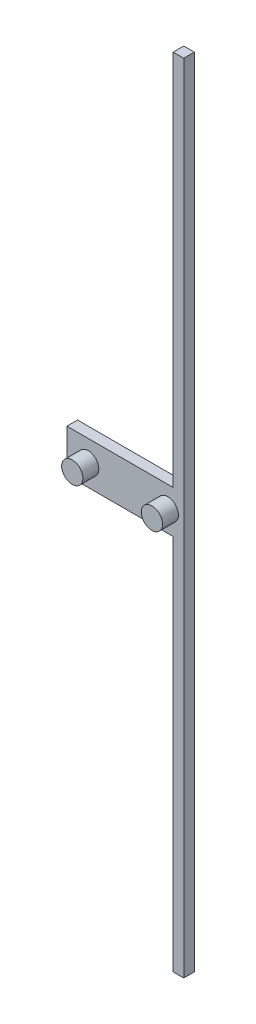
SolidWorks part; units mm, degrees
ref_plane "Face" through (0, 0, 0) normal (0, 0, 1) x (1, 0, 0)
ref_plane "Dessus" through (0, 0, 0) normal (0, 1, 0) x (1, 0, 0)
ref_plane "Droite" through (0, 0, 0) normal (1, 0, 0) x (0, 0, -1)
sketch "Esquisse1" plane through (0, 0, 0) normal (0, 0, 1) x (1, 0, 0)
  line L0 (200, 0) -> (200, -710)
  line L1 (0, 0) -> (200, 0)
  line L2 (0, 0) -> (0, 80)
  line L3 (0, 80) -> (200, 80)
  line L5 (200, 790) -> (220, 790)
  line L6 (200, 790) -> (200, 80)
  line L7 (200, -710) -> (220, -710)
  line L8 (220, 790) -> (220, -710)
  dimension "D1" = 200
  dimension "D2" = 1500
  dimension "D3" = 80
  dimension "D4" = 20
extrude "Extrusion1" add sketch "Esquisse1" along normal blind 20
sketch "Esquisse2" plane through (0, 0, 20) normal (0, 0, 1) x (1, 0, 0)
  line L0 (0, 80) -> (0, 0) construction
  line L1 (200, 80) -> (0, 80) construction
  circle A0 centre (40, 40) radius 20
  circle A1 centre (190, 40) radius 20
  dimension "D1" = 40
  dimension "D2" = 150
  dimension "D3" = 40
  dimension "D4" = 40
extrude "Extrusion2" add sketch "Esquisse2" along normal blind 30
